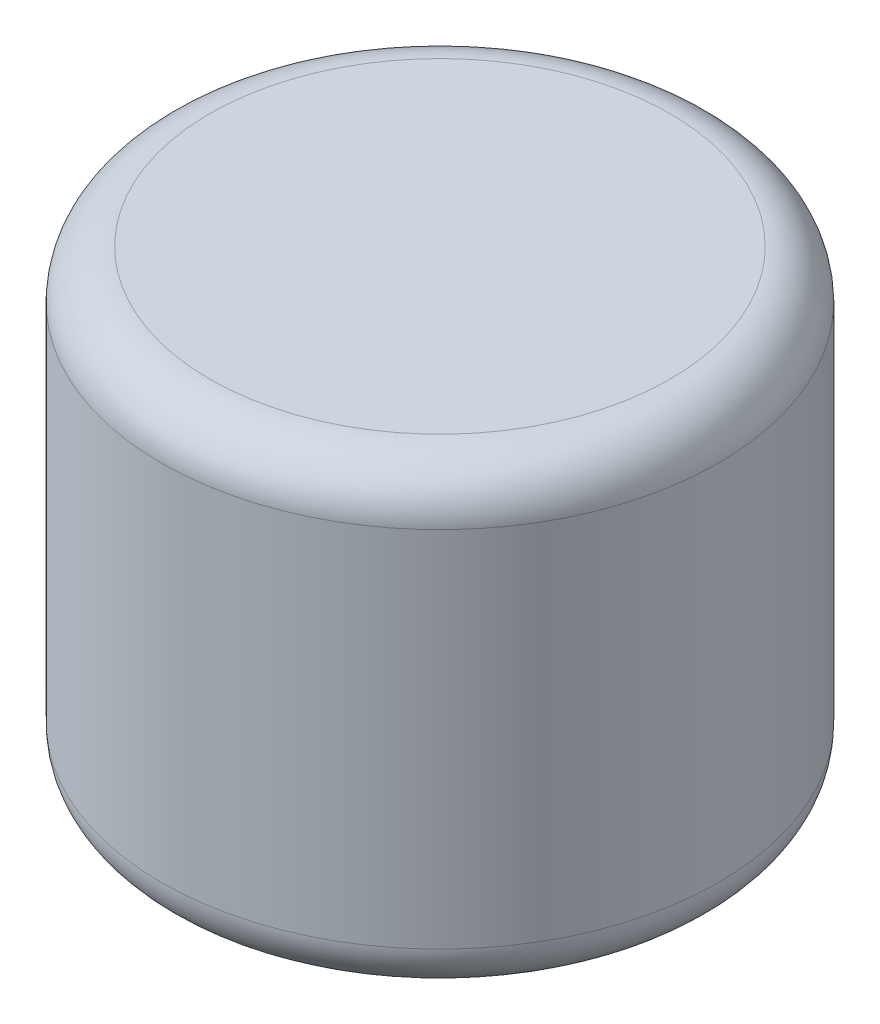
SolidWorks part; units mm, degrees
ref_plane "Front Plane" through (0, 0, 0) normal (0, 0, 1) x (1, 0, 0)
ref_plane "Top Plane" through (0, 0, 0) normal (0, 1, 0) x (1, 0, 0)
ref_plane "Right Plane" through (0, 0, 0) normal (1, 0, 0) x (0, 0, -1)
sketch "Sketch1" plane through (0, 0, 0) normal (0, 1, 0) x (1, 0, 0)
  circle A0 centre (0, 0) radius 11.5
  dimension "D1" = 23
extrude "Boss-Extrude1" add sketch "Sketch1" along normal blind 19
fillet "Fillet1" radius 2 2 edges at (0, 0, 11.5) (0, 19, 11.5)
